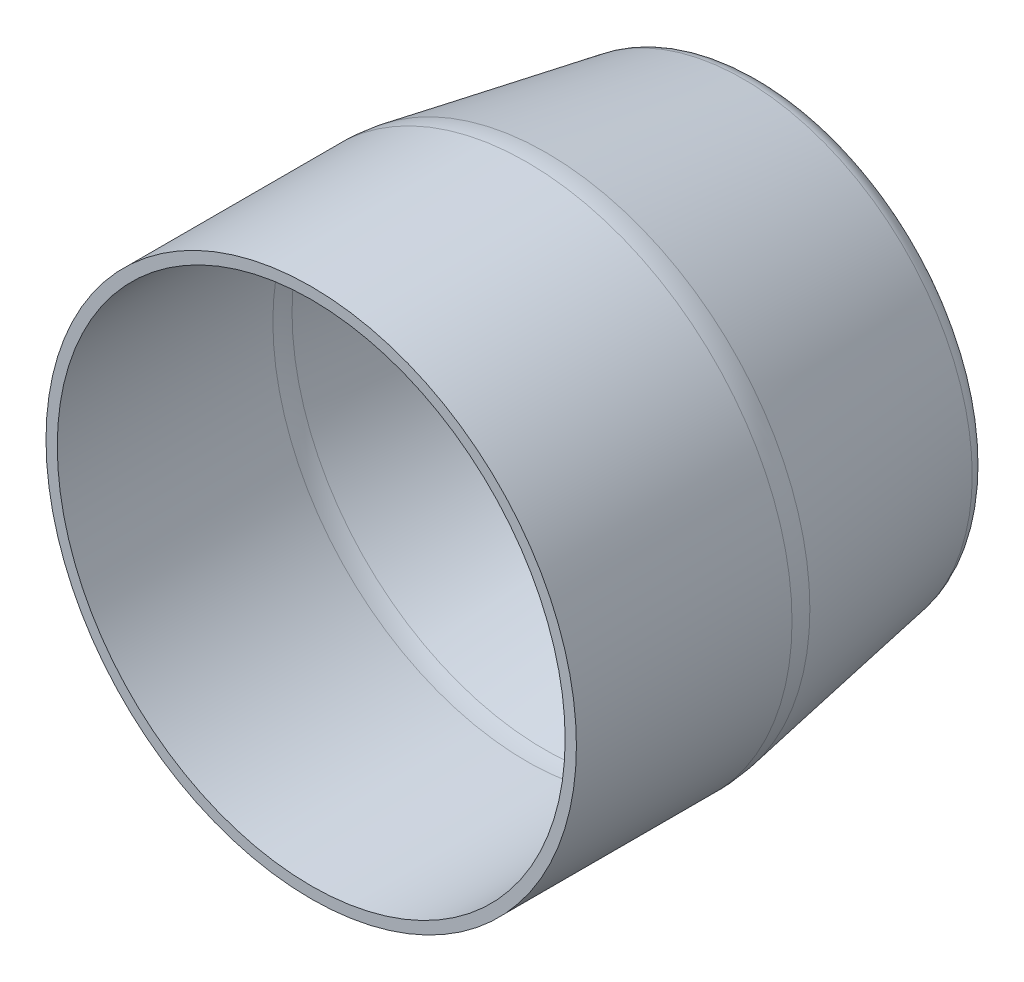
SolidWorks part; units mm, degrees
ref_plane "Front" through (0, 0, 0) normal (0, 0, 1) x (1, 0, 0)
ref_plane "Top" through (0, 0, 0) normal (0, 1, 0) x (1, 0, 0)
ref_plane "Right" through (0, 0, 0) normal (1, 0, 0) x (0, 0, -1)
sketch "Sketch1" plane through (0, 0, 0) normal (0, 0, 1) x (1, 0, 0)
  line L0 (0, 0) -> (1198.8129, 0) construction
  circle A0 centre (0, 0) radius 1000
  dimension "D1" = 2000
extrude "Extrude1" add sketch "Sketch1" along normal blind 1000 draft 10
sketch "Sketch3" plane through (0, 0, 1000) normal (0, 0, 1) x (1, 0, 0)
  circle A1 centre (0, 0) radius 1176.327
  circle A2 centre (0, 0) radius 1176.327
  dimension "D1" = 0
extrude "Extrude2" add sketch "Sketch3" along normal blind 1000
fillet "Fillet1" radius 100 1 edges at (1000, 0, 0)
fillet "Fillet2" radius 500 1 edges at (1176.327, 0, 1000)
shell "Shell1" thickness 50
sketch "Sketch2" plane through (0, 0, 2000) normal (0, 0, -1) x (-1, 0, 0)
  line L0 (0, 0) -> (1928.7672, 0) construction
  line L1 (0, 0) -> (0, 1697.6619) construction
  point P0 (0, 0)
